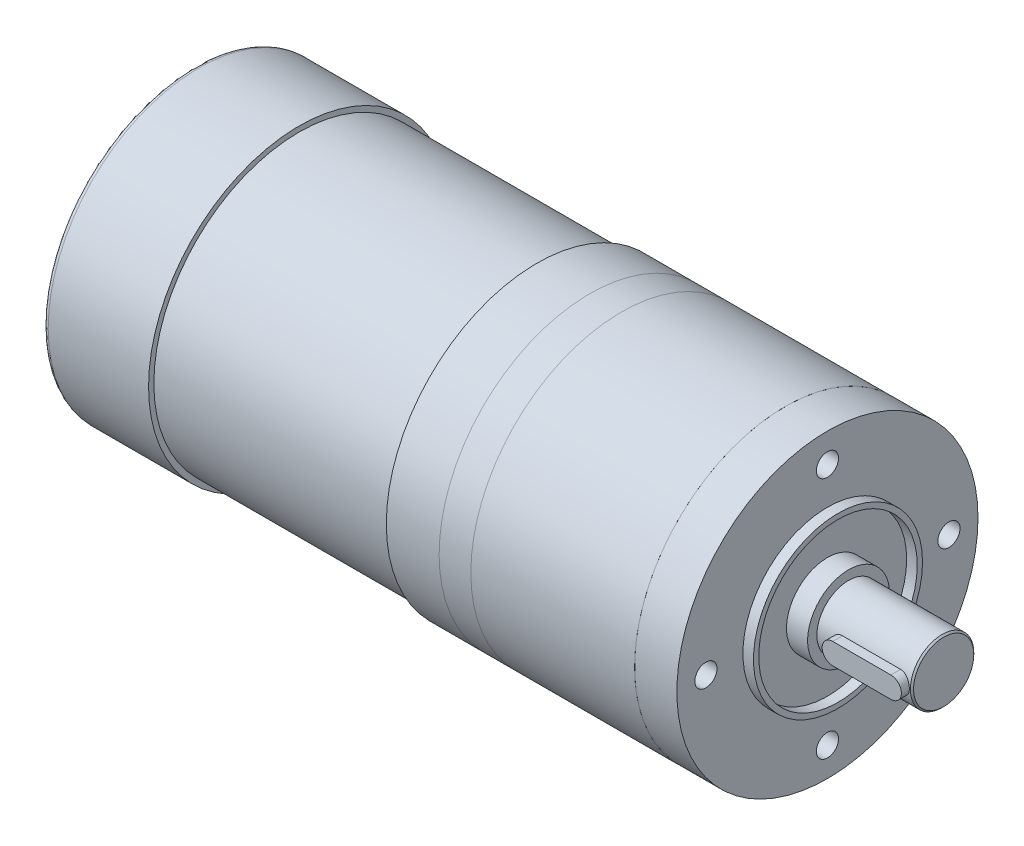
SolidWorks part; units mm, degrees
ref_plane "前视基准面" through (0, 0, 0) normal (0, 0, 1) x (1, 0, 0)
ref_plane "上视基准面" through (0, 0, 0) normal (0, 1, 0) x (1, 0, 0)
ref_plane "右视基准面" through (0, 0, 0) normal (1, 0, 0) x (0, 0, -1)
sketch "草图1" plane through (0, 0, 0) normal (1, 0, 0) x (0, 0, -1)
  circle A0 centre (0, 0) radius 28.5
extrude "凸台-拉伸1" add sketch "草图1" against normal blind 8
sketch "草图2" plane through (-8, 0, 0) normal (-1, 0, 0) x (0, 0, 1)
  circle A0 centre (0, 0) radius 28.5
extrude "凸台-拉伸2" add sketch "草图2" along normal blind 31 separate body
sketch "草图3" plane through (-39, 0, 0) normal (-1, 0, 0) x (0, 0, 1)
  circle A0 centre (0, 0) radius 28.5
extrude "凸台-拉伸3" add sketch "草图3" along normal blind 6 separate body
sketch "草图4" plane through (-45, 0, 0) normal (-1, 0, 0) x (0, 0, 1)
  circle A0 centre (0, 0) radius 28.5
extrude "凸台-拉伸4" add sketch "草图4" along normal blind 10 separate body
sketch "草图5" plane through (-55, 0, 0) normal (-1, 0, 0) x (0, 0, 1)
  circle A0 centre (0, 0) radius 27.5
extrude "凸台-拉伸5" add sketch "草图5" along normal blind 45
sketch "草图6" plane through (-100, 0, 0) normal (-1, 0, 0) x (0, 0, 1)
  circle A0 centre (0, 0) radius 28.5
extrude "凸台-拉伸6" add sketch "草图6" along normal blind 20
fillet "圆角1" radius 1 1 edges at (-120, 0, 28.5)
sketch "草图7" plane through (0, 0, 0) normal (1, 0, 0) x (0, 0, -1)
  circle A0 centre (0, 0) radius 16
  circle A1 centre (0, 0) radius 15
extrude "凸台-拉伸7" add sketch "草图7" along normal blind 2
sketch "草图8" plane through (0, 0, 0) normal (1, 0, 0) x (0, 0, -1)
  circle A0 centre (0, 0) radius 7.75
extrude "凸台-拉伸8" add sketch "草图8" along normal blind 4
sketch "草图9" plane through (4, 0, 0) normal (1, 0, 0) x (0, 0, -1)
  circle A0 centre (0, 0) radius 6
extrude "凸台-拉伸9" add sketch "草图9" along normal blind 18
sketch "草图10" plane through (0, 0, 0) normal (1, 0, 0) x (0, 0, -1)
  point P3 (0, 23)
  point P4 (23, 0)
  point P5 (0, -23)
  point P6 (-23, 0)
hole_wizard "M5 螺纹孔1" positions "3D草图1" profile "草图11" tap size "M5" standard "GB"
sketch3d "3D草图1"
  point P0 (0, 23, 0)
  point P3 (0, 0, -23)
  point P6 (0, -23, 0)
  point P9 (0, 0, 23)
sketch "草图11" plane through (0, 23, 0) normal (0, 1, 0) x (0, 0, -1)
  line L0 (0, 0) -> (0, 15.2618)
  line L1 (0, 15.2618) -> (2.1, 14)
  line L2 (2.1, 14) -> (2.1, 0)
  line L5 (2.1, 0) -> (0, 0)
  line L10 (0, 15.2618) -> (-2.1, 14) construction
  line L11 (0, -6.35) -> (0, 107.95) construction
  dimension "螺纹孔钻头直径" = 4.2
  dimension "螺纹孔钻头深度" = 14
  dimension "导头角度" = 118
ref_plane "基准面1" through (0, 0, 6) normal (0, 0, 1) x (1, 0, 0)
sketch "草图12" plane through (0, 0, 6) normal (0, 0, 1) x (1, 0, 0)
  line L3 (8.5, 2) -> (19.5, 2)
  line L5 (19.5, -2) -> (8.5, -2)
  arc A0 (19.5, -2) -> (19.5, 2) centre (19.5, 0) ccw
  arc A1 (8.5, 2) -> (8.5, -2) centre (8.5, 0) ccw
extrude "切除-拉伸1" cut sketch "草图12" against normal blind 2.5
sketch "草图13" plane through (0, 0, 3.5) normal (0, 0, 1) x (1, 0, 0)
  line L0 (8.5, 2) -> (19.5, 2)
  line L2 (19.5, -2) -> (8.5, -2)
  arc A0 (8.5, 2) -> (8.5, -2) centre (8.5, 0) ccw
  arc A1 (19.5, -2) -> (19.5, 2) centre (19.5, 0) ccw
extrude "凸台-拉伸10" add sketch "草图13" along normal blind 4 separate body
chamfer "倒角1" distance 0.3 angle 45 1 edges at (22, 0, -6)
